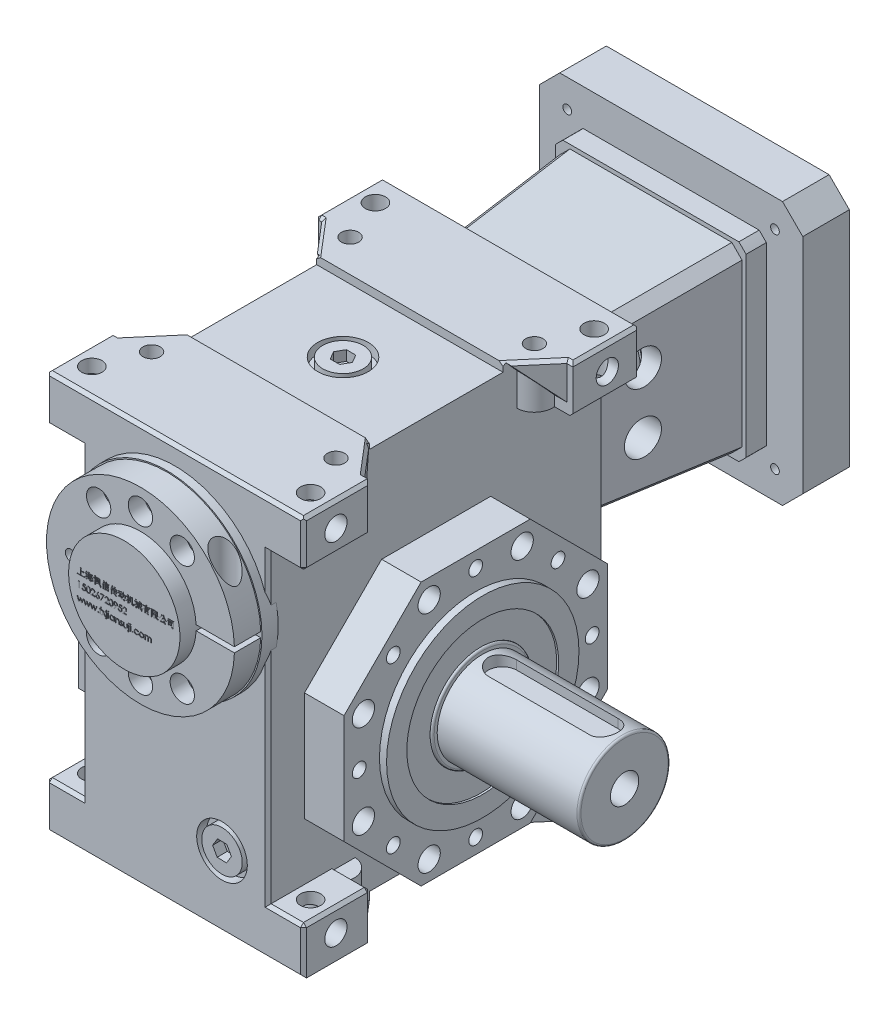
SolidWorks part; units mm, degrees
ref_plane "前视基准面" through (0, 0, 0) normal (0, 0, 1) x (1, 0, 0)
ref_plane "上视基准面" through (0, 0, 0) normal (0, 1, 0) x (1, 0, 0)
ref_plane "右视基准面" through (0, 0, 0) normal (1, 0, 0) x (0, 0, -1)
imported_body "JDLB063-CR箱体-1-solid1"
imported_body "JDLB063-CR箱体-1-solid2"
imported_body "JDLB063-ASR实心轴Φ45-1-solid1"
imported_body "JDLB063-ST94输入法兰-1-solid1"
imported_body "ST130-110-145-M8伺服法兰接口-1-solid1"
imported_body "联轴器BD56-60-20-22锁紧-2-solid1"
imported_body "联轴器BD56-60-20-22锁紧-2-solid2"
imported_body "联轴器BD56-60-20-22锁紧-2-solid3"
imported_body "联轴器BD56-60-20-22锁紧-2-solid4"
imported_body "联轴器BD56-60-20-22锁紧-2-solid5"
imported_body "联轴器BD56-60-20-22锁紧-2-solid6"
imported_body "联轴器BD56-60-20-22锁紧-2-solid7"
imported_body "联轴器BD56-60-20-22锁紧-2-solid8"
imported_body "联轴器BD56-60-20-22锁紧-2-solid9"
imported_body "联轴器BD56-60-20-22锁紧-2-solid10"
imported_body "联轴器BD56-60-20-22锁紧-2-solid11"
sketch "草图1" plane through (47, 0, 0) normal (1, 0, 0) x (0, 0, -1)
  line L1 (-30.8041, 101.5658) -> (30.5569, 101.5658)
  line L2 (-30.8041, 101.5658) -> (-30.8041, 86.956)
  line L3 (-30.8041, 86.956) -> (30.5569, 86.956)
  line L4 (30.5569, 101.5658) -> (30.5569, 86.956)
extrude "切除-拉伸1" cut sketch "草图1" against normal up to surface (1 mm away)
sketch "草图2" plane through (-47, 0, 0) normal (-1, 0, 0) x (0, 0, 1)
  line L1 (-27.1617, 100.3757) -> (24.2598, 100.3757)
  line L2 (-27.1617, 100.3757) -> (-27.1617, 86.0032)
  line L3 (-27.1617, 86.0032) -> (24.2598, 86.0032)
  line L4 (24.2598, 100.3757) -> (24.2598, 86.0032)
extrude "切除-拉伸2" cut sketch "草图2" against normal up to surface (1 mm away)
sketch "草图3" plane through (0, 0, 108) normal (0, 0, 1) x (1, 0, 0)
  text T0 "上海枫信传动机械有限公司  15026720952  www.fxjiansuji.com" font "Century Gothic" height in points 11
extrude "凸台-拉伸1" add sketch "草图3" along normal blind 0.2
